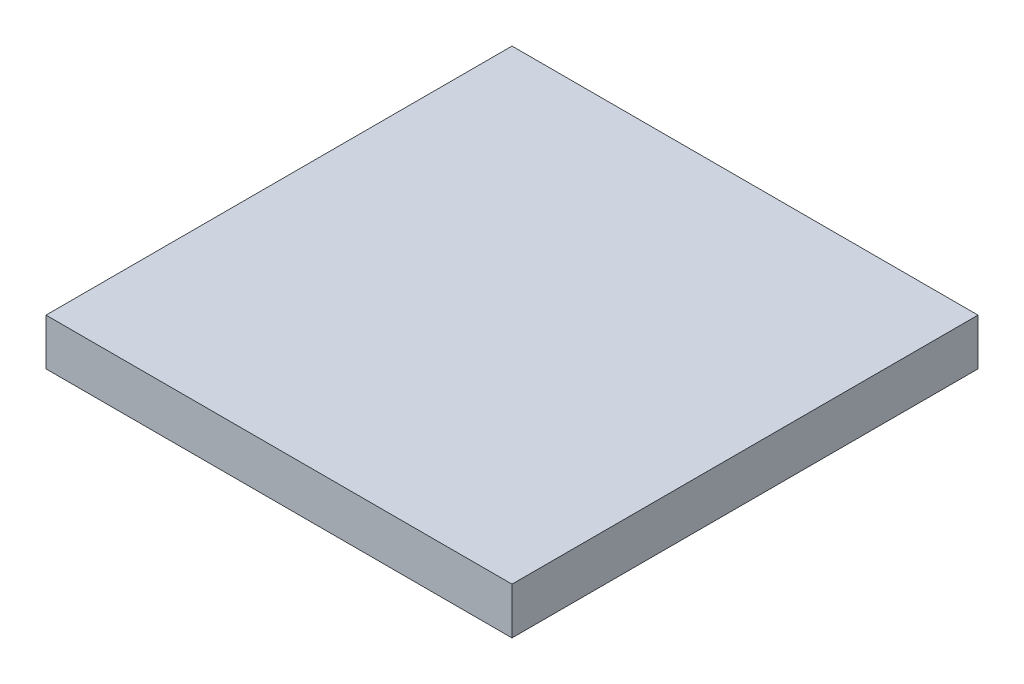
SolidWorks part; units mm, degrees
ref_plane "Front Plane" through (0, 0, 0) normal (0, 0, 1) x (1, 0, 0)
ref_plane "Top Plane" through (0, 0, 0) normal (0, 1, 0) x (1, 0, 0)
ref_plane "Right Plane" through (0, 0, 0) normal (1, 0, 0) x (0, 0, -1)
sketch "Sketch1" plane through (0, 0, 0) normal (0, 1, 0) x (1, 0, 0)
  line L1 (0, 0) -> (40, 0)
  line L2 (0, 0) -> (0, 40)
  line L3 (0, 40) -> (40, 40)
  line L4 (40, 0) -> (40, 40)
  dimension "D1" = 40
  dimension "D2" = 40
extrude "Extrude1" add sketch "Sketch1" along normal blind 4
